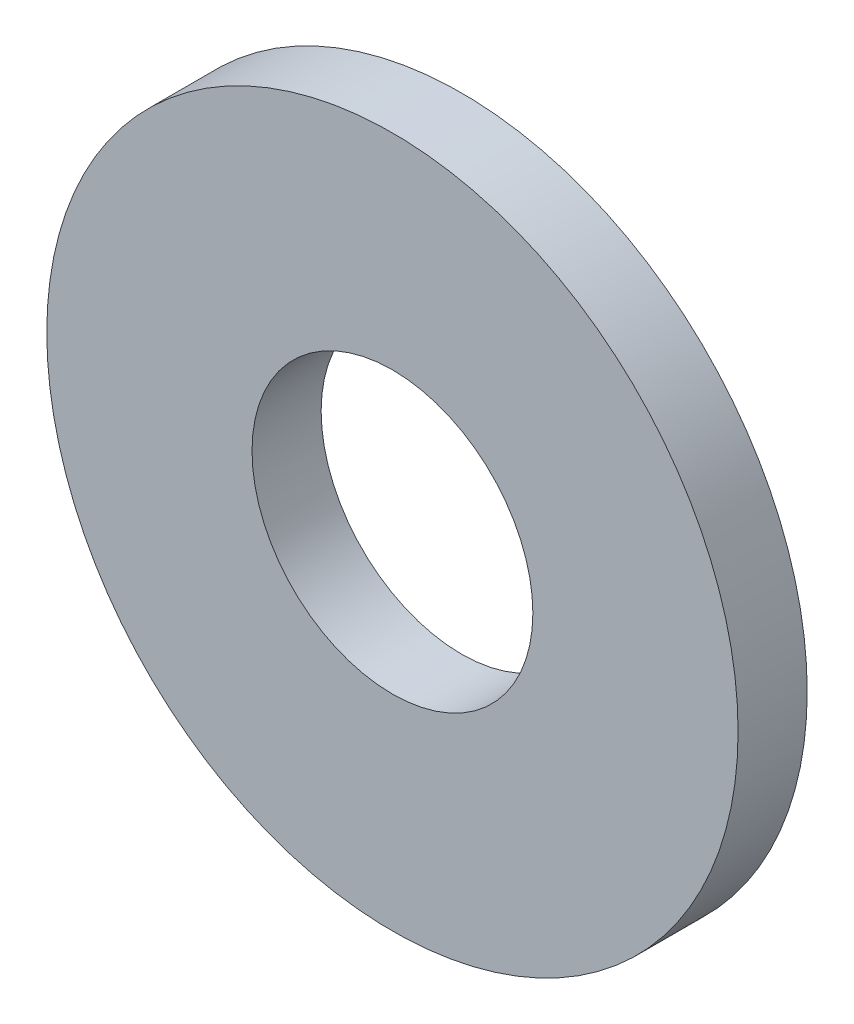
SolidWorks part; units mm, degrees
ref_plane "Plan1" through (0, 0, 0) normal (0, 0, 1) x (1, 0, 0)
ref_plane "Plan2" through (0, 0, 0) normal (0, 1, 0) x (1, 0, 0)
ref_plane "Plan3" through (0, 0, 0) normal (1, 0, 0) x (0, 0, -1)
sketch "Esquisse1" plane through (0, 0, 0) normal (0, 0, 1) x (1, 0, 0)
  circle A0 centre (0, 0) radius 1.625
  circle A1 centre (0, 0) radius 4
  dimension "D1" = 3.25
  dimension "D2" = 8
extrude "Base-Extrusion" add sketch "Esquisse1" along normal mid plane 0.8
